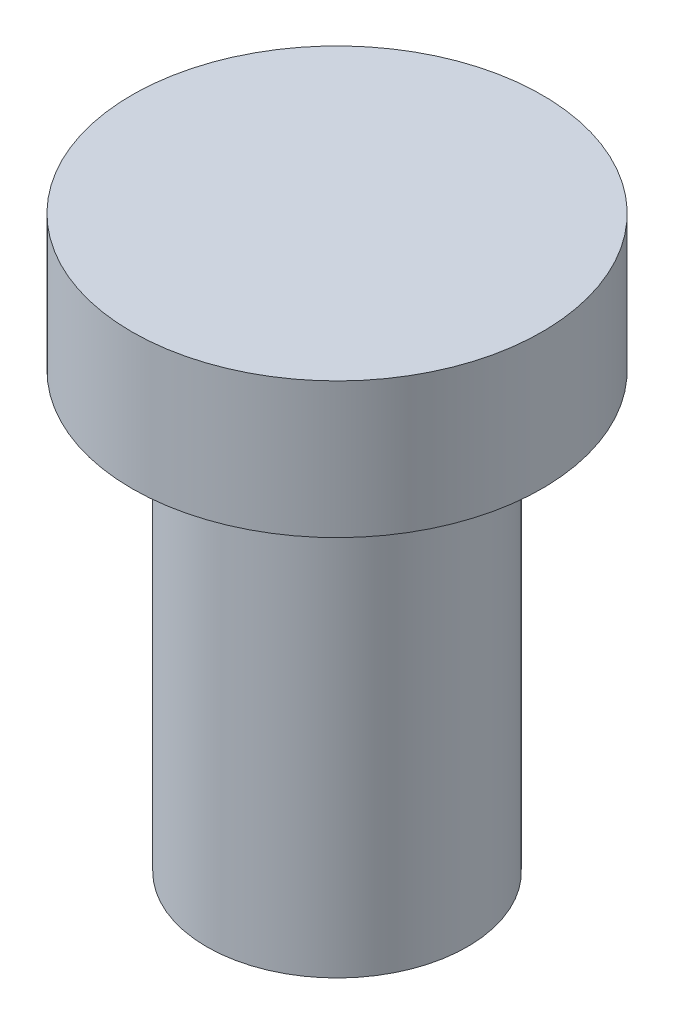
SolidWorks part; units mm, degrees
ref_plane "Front Plane" through (0, 0, 0) normal (0, 0, 1) x (1, 0, 0)
ref_plane "Top Plane" through (0, 0, 0) normal (0, 1, 0) x (1, 0, 0)
ref_plane "Right Plane" through (0, 0, 0) normal (1, 0, 0) x (0, 0, -1)
sketch "Sketch1" plane through (0, 0, 0) normal (0, 1, 0) x (1, 0, 0)
  circle A0 centre (0, 0) radius 3.05
  dimension "D1" = 6.1
extrude "Extrude1" add sketch "Sketch1" along normal blind 10.16
sketch "Sketch2" plane through (0, 10.16, 0) normal (0, 1, 0) x (-1, 0, 0)
  circle A0 centre (0, 0) radius 4.7999
extrude "Extrude2" add sketch "Sketch2" along normal blind 3.175
